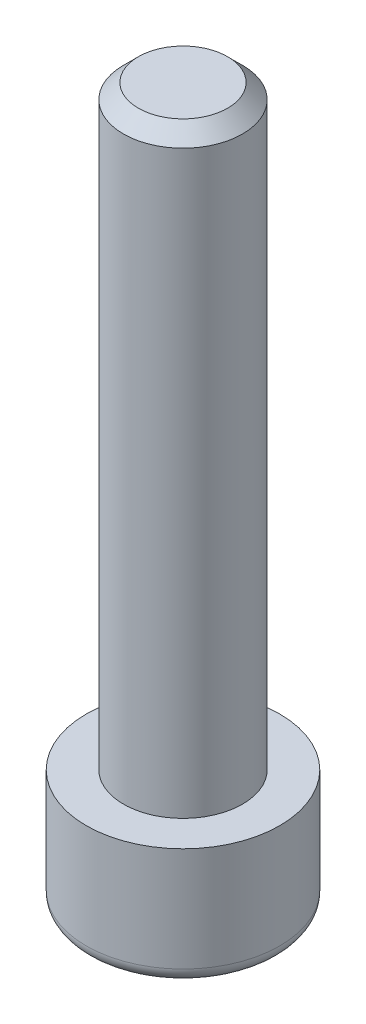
SolidWorks part; units mm, degrees
ref_plane "Plan de face" through (0, 0, 0) normal (0, 0, 1) x (1, 0, 0)
ref_plane "Plan de dessus" through (0, 0, 0) normal (0, 1, 0) x (1, 0, 0)
ref_plane "Plan de droite" through (0, 0, 0) normal (1, 0, 0) x (0, 0, -1)
sketch "Esquisse1" plane through (0, 0, 0) normal (0, 1, 0) x (1, 0, 0)
  circle A0 centre (0, 0) radius 4
  dimension "D1" = 8
extrude "Extrusion1" add sketch "Esquisse1" along normal blind 40
chamfer "Chanfrein1" distance 1 angle 45 1 edges at (0, 40, 4)
sketch "Esquisse2" plane through (0, 0, 0) normal (0, -1, 0) x (1, 0, 0)
  circle A0 centre (0, 0) radius 6.5
  dimension "D1" = 13
extrude "Extrusion2" add sketch "Esquisse2" along normal blind 8
fillet "Congé1" radius 1 1 edges at (0, -8, -6.5)
sketch "Esquisse3" plane through (0, -8, 0) normal (0, -1, 0) x (1, 0, 0)
  line L0 (-3, 1.7292) -> (0, 3.45)
  line L1 (0, 3.45) -> (3, 1.7292)
  line L2 (3, 1.7292) -> (3, -1.7292)
  line L3 (3, -1.7292) -> (0, -3.45)
  line L4 (0, -3.45) -> (-3, -1.7292)
  line L5 (-3, -1.7292) -> (-3, 1.7292)
  line L6 (0, 3.45) -> (0, -3.45) construction
  line L7 (-3, 0) -> (3, 0) construction
  dimension "D1" = 6
  dimension "D2" = 6.9
extrude "Enlèv. mat.-Extru.1" cut sketch "Esquisse3" against normal blind 6
